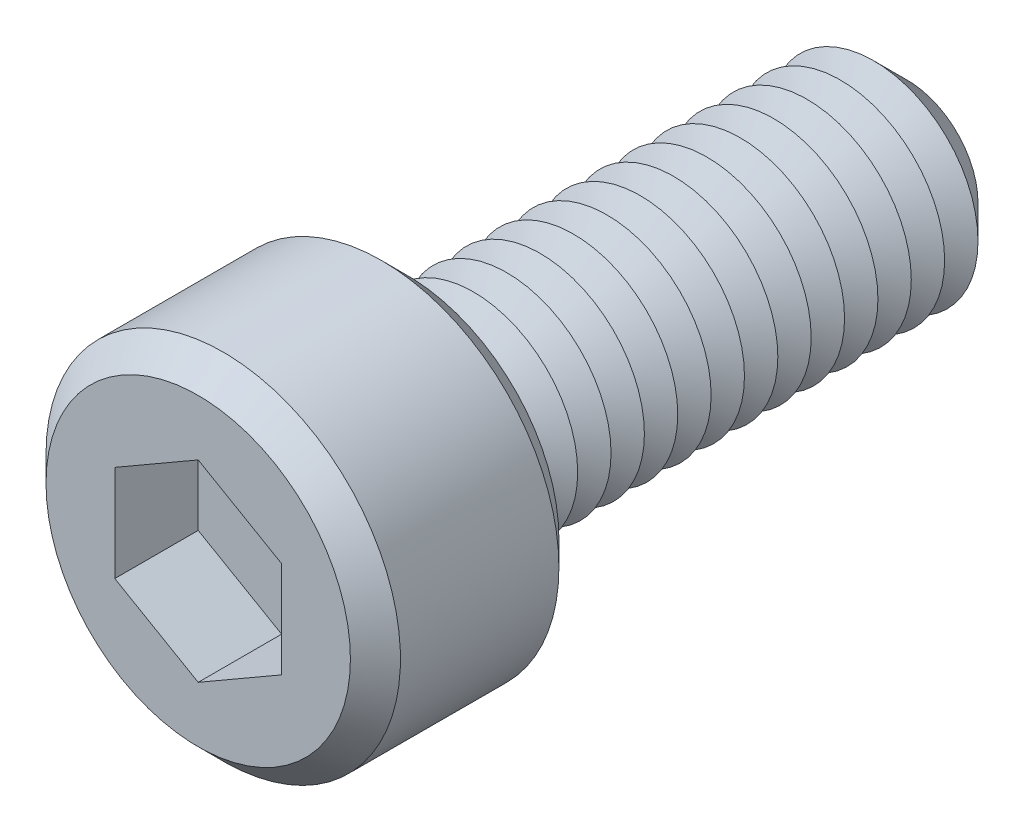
SolidWorks part; units mm, degrees
ref_plane "Front Plane" through (0, 0, 0) normal (0, 0, 1) x (1, 0, 0)
ref_plane "Top Plane" through (0, 0, 0) normal (0, 1, 0) x (1, 0, 0)
ref_plane "Right Plane" through (0, 0, 0) normal (1, 0, 0) x (0, 0, -1)
sketch "Sketch1" plane through (0, 0, 0) normal (0, 0, 1) x (1, 0, 0)
  circle A0 centre (0, 0) radius 4.25
  dimension "D1" = 8.5
extrude "Boss-Extrude1" add sketch "Sketch1" along normal blind 5
sketch "Sketch2" plane through (0, 0, 0) normal (0, 0, -1) x (-1, 0, 0)
  circle A0 centre (0, 0) radius 2.5
  dimension "D1" = 5
extrude "Boss-Extrude2" add sketch "Sketch2" along normal blind 12
chamfer "Chamfer1" distance 0.8 angle 45 1 edges at (-2.5, 0, -12)
sketch "Sketch3" plane through (0, 0, 0) normal (1, 0, 0) x (0, 0, -1)
  line L0 (-2.5121, 0) -> (4.5776, 0) construction
sketch "Sketch4" plane through (0, 0, 0) normal (1, 0, 0) x (0, 0, -1)
  line L0 (0, 2.5) -> (0.4, 1.8072)
  line L1 (0.4, 1.8072) -> (0.8, 2.5)
  line L2 (11.2, 2.5) -> (0, 2.5) construction
  line L3 (0.8, 2.5) -> (0, 2.5)
  dimension "D1" = 0.8
revolve "Cut-Revolve1" cut sketch "Sketch4" angle 360 about L0
pattern_linear "LPattern1" count 14 spacing 0.8 along (0, 0, -1) of "Cut-Revolve1"
sketch "Sketch5" plane through (0, 0, 5) normal (0, 0, 1) x (1, 0, 0)
  line L1 (0, 2.3094) -> (-2, 1.1547)
  line L2 (-2, 1.1547) -> (-2, -1.1547)
  line L3 (-2, -1.1547) -> (0, -2.3094)
  line L4 (0, -2.3094) -> (2, -1.1547)
  line L5 (2, -1.1547) -> (2, 1.1547)
  line L6 (2, 1.1547) -> (0, 2.3094)
  circle A0 centre (0, 0) radius 2 construction
  dimension "D1" = 4
extrude "Cut-Extrude1" cut sketch "Sketch5" against normal blind 2
sketch "Sketch6" plane through (0, 0, 3) normal (0, 0, 1) x (1, 0, 0)
  circle A0 centre (0, 0) radius 0.65
  dimension "D1" = 1.3
extrude "Cut-Extrude2" cut sketch "Sketch6" against normal up to surface (15 mm away)
chamfer "Chamfer2" distance 0.6 angle 45 2 edges at (4.25, 0, 0) (4.25, 0, 5)
